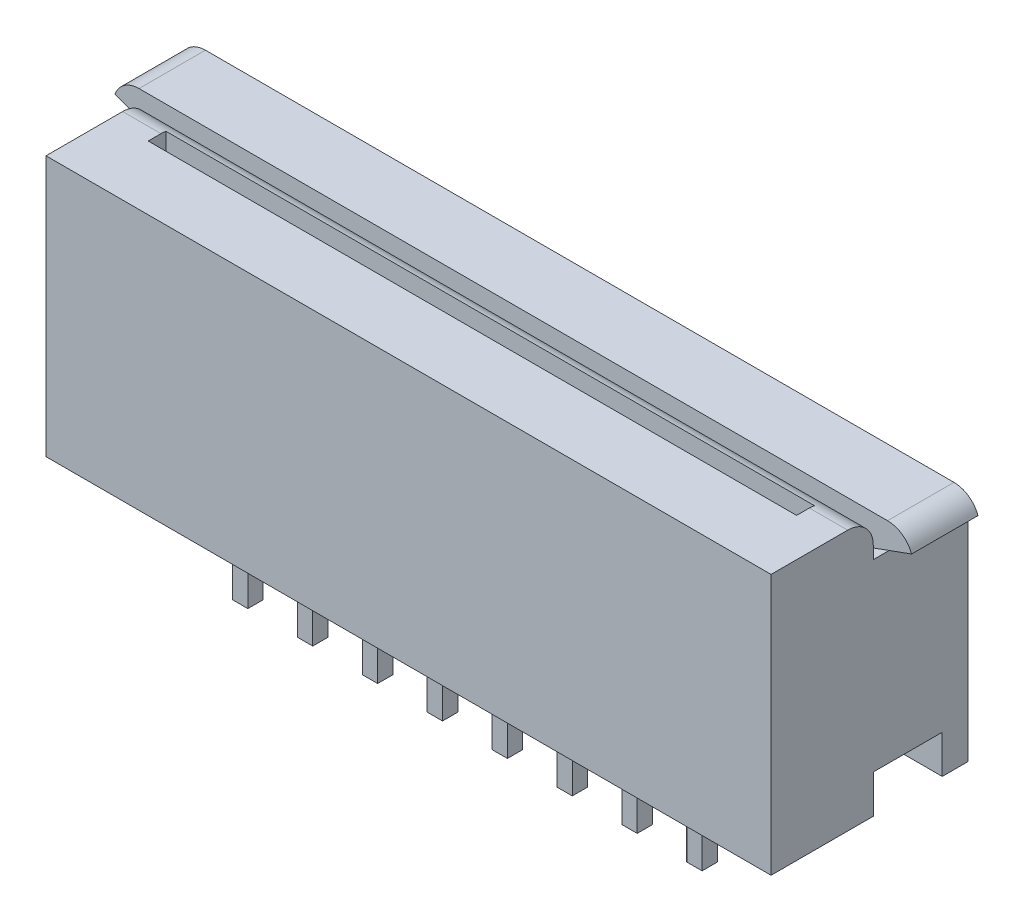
SolidWorks part; units mm, degrees
ref_plane "Front" through (0, 0, 0) normal (0, 0, 1) x (1, 0, 0)
ref_plane "Top" through (0, 0, 0) normal (0, 1, 0) x (1, 0, 0)
ref_plane "Right" through (0, 0, 0) normal (1, 0, 0) x (0, 0, -1)
sketch "Эскиз1" plane through (0, 0, 0) normal (1, 0, 0) x (0, 0, -1)
  line L0 (-2.6, 0) -> (1.4, 0)
  line L1 (1.4, 0) -> (1.4, 1.5)
  line L2 (1.4, 1.5) -> (4.1, 1.5)
  line L3 (4.1, 1.5) -> (4.1, 0)
  line L4 (4.1, 0) -> (5.1, 0)
  line L5 (5.1, 0) -> (5.1, 8.7)
  line L6 (5.1, 8.7) -> (1.4, 8.7)
  line L7 (1.4, 8.7) -> (1.4, 9.2)
  line L8 (0.4, 10.2) -> (-2.6, 10.2)
  line L9 (-2.6, 10.2) -> (-2.6, 0)
  arc A0 (1.4, 9.2) -> (0.4, 10.2) centre (0.4, 9.2) ccw
  point P13 (1.4, 10.2)
  dimension "D7" = 1
  dimension "D1" = 10.2
  dimension "D2" = 7.7
  dimension "D3" = 4
  dimension "D4" = 1.5
  dimension "D5" = 1
  dimension "D6" = 1.5
  dimension "D8" = 2.6
extrude "Вытянуть1" add sketch "Эскиз1" along normal blind 23.08 and the other way blind 5.3
sketch "Эскиз2" plane through (0, 8.7, 0) normal (0, 1, 0) x (-1, 0, 0)
  line L0 (-8.89, -5.1) -> (-8.89, 2.6) construction
  line L1 (4, -4.1) -> (-21.78, -4.1)
  line L2 (4, -4.1) -> (4, -1.5)
  line L3 (4, -1.5) -> (-21.78, -1.5)
  line L4 (-21.78, -4.1) -> (-21.78, -1.5)
  line L5 (-23.08, -5.1) -> (5.3, -5.1) construction
  line L6 (-23.08, 2.6) -> (5.3, 2.6) construction
  line L7 (-23.08, -4.1) -> (5.3, -4.1) construction
  line L8 (5.3, -5.1) -> (5.3, -1.4) construction
  dimension "D1" = 4.1
  dimension "D2" = 1.3
extrude "Вытянуть2" add sketch "Эскиз2" along normal blind 1.5
sketch "Эскиз3" plane through (0, 0, -1.5) normal (0, 0, 1) x (1, 0, 0)
  line L0 (8.89, 10.2) -> (8.89, 0) construction
  line L1 (-4, 10.2) -> (21.78, 10.2) construction
  line L2 (23.08, 10.2) -> (-5.3, 10.2) construction
  line L3 (21.78, 10.2) -> (23.5398, 10.2)
  line L4 (-4, 10.2) -> (-5.7598, 10.2)
  line L5 (23.08, 0) -> (-5.3, 0) construction
  line L7 (24.48, 9.5416) -> (22.909, 8.9698)
  line L8 (-6.7, 9.5416) -> (-4.8, 8.8501)
  line L9 (22.58, 8.5) -> (22.58, 7.7)
  line L10 (-4.8, 8.8501) -> (-4.8, 7.7)
  line L11 (22.58, 7.7) -> (21.78, 7.7)
  line L12 (-4.8, 7.7) -> (-4, 7.7)
  line L13 (21.78, 7.7) -> (21.78, 10.2)
  line L14 (-4, 7.7) -> (-4, 10.2)
  arc A0 (23.5398, 10.2) -> (24.48, 9.5416) centre (23.5398, 9.1994) cw
  arc A1 (-5.7598, 10.2) -> (-6.7, 9.5416) centre (-5.7598, 9.1994) ccw
  arc A2 (22.909, 8.9698) -> (22.58, 8.5) centre (23.08, 8.5) ccw
  point P24 (22.58, 8.8501)
  dimension "D4" = 0.5
  dimension "D1" = 0.8
  dimension "B" = 31.18
  dimension "D2" = 0.8
  dimension "D3" = 20
  dimension "D5" = 2.5
extrude "Вытянуть3" add sketch "Эскиз3" against normal up to surface (2.6 mm away)
sketch "Эскиз4" plane through (0, 10.2, 0) normal (0, 1, 0) x (-1, 0, 0)
  line L0 (-8.89, 2.6) -> (-8.89, 0.1) construction
  line L1 (3.8, -0.6) -> (-21.58, -0.6)
  line L2 (3.8, -0.6) -> (3.8, 0.1)
  line L3 (3.8, 0.1) -> (-21.58, 0.1)
  line L4 (-21.58, -0.6) -> (-21.58, 0.1)
  line L5 (-23.08, 2.6) -> (5.3, 2.6) construction
  line L6 (5.3, -0.4) -> (5.3, 2.6) construction
  dimension "D1" = 2.5
  dimension "D2" = 0.7
  dimension "D3" = 1.5
extrude "Вырез-Вытянуть1" cut sketch "Эскиз4" against normal blind 4
sketch "Эскиз5" plane through (0, 0, 0) normal (0, -1, 0) x (1, 0, 0)
  line L0 (0, -0.3) -> (0, 0.3) construction
  line L1 (-0.3, 0.3) -> (0.3, 0.3)
  line L2 (-0.3, 0.3) -> (-0.3, -0.3)
  line L3 (-0.3, -0.3) -> (0.3, -0.3)
  line L4 (0.3, 0.3) -> (0.3, -0.3)
  dimension "D1" = 0.6
extrude "Вытянуть4" add sketch "Эскиз5" along normal blind 3.5
pattern_linear "Линейный массив1" count 8 spacing 2.54 along (1, 0, 0) of "Вытянуть4"
sketch "Эскиз6" plane through (0, 0, 0) normal (0, -1, 0) x (1, 0, 0)
  line L1 (0, -0.3) -> (0, 0.3) construction
  circle A0 centre (-2.54, 0) radius 0.75
  dimension "D2" = 1.5
  dimension "BOSS" = 2.54
extrude "Вытянуть5" add sketch "Эскиз6" along normal blind 1.5
fillet "Скругление1" radius 0.5 1 edges at (-2.54, -1.5, -0.75)
equation "\"L@Вытянуть1\" =  ( \"N@Линейный массив1\" - 1 )  * 2.54  + 5.3"
equation "\"B@Эскиз3\" =  ( \"N@Линейный массив1\" - 1 )  * 2.54 + 13.4"
